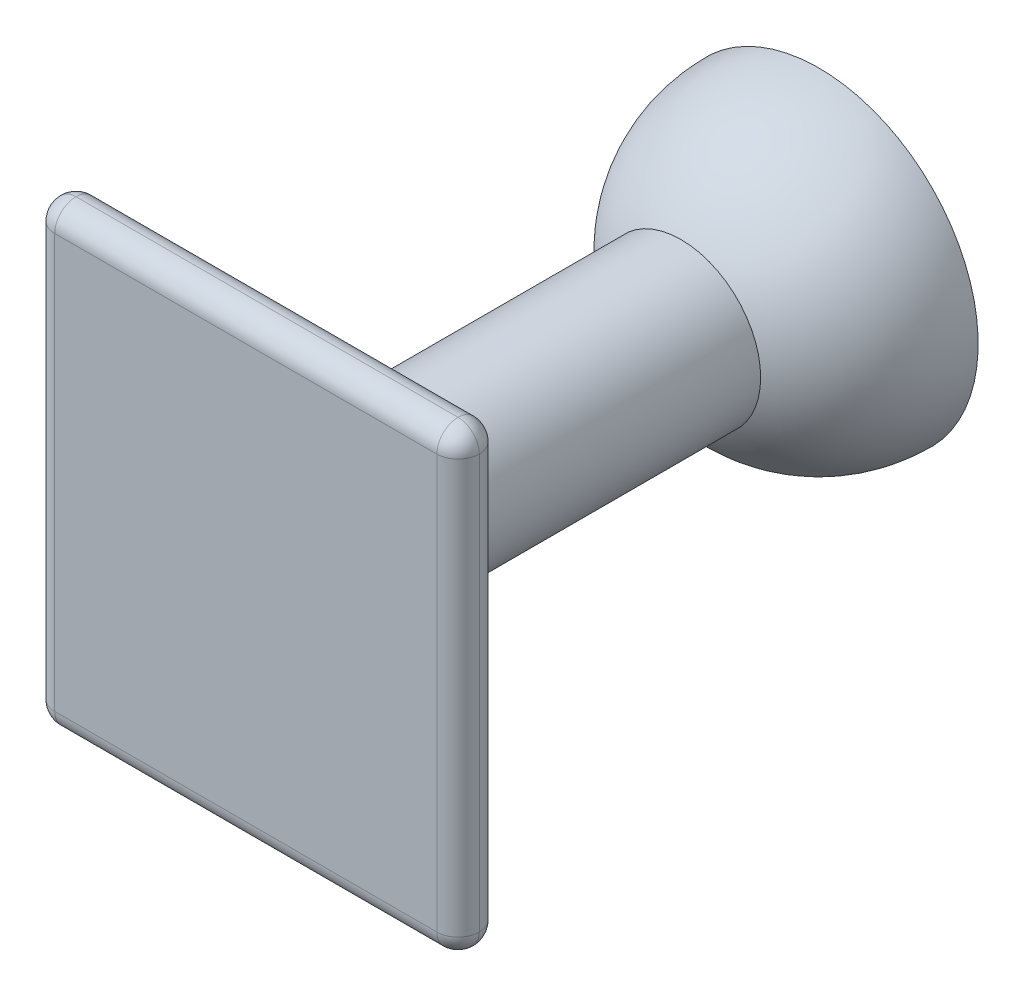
SolidWorks part; units mm, degrees
ref_plane "Front Plane" through (0, 0, 0) normal (0, 0, 1) x (1, 0, 0)
ref_plane "Top Plane" through (0, 0, 0) normal (0, 1, 0) x (1, 0, 0)
ref_plane "Right Plane" through (0, 0, 0) normal (1, 0, 0) x (0, 0, -1)
sketch "Sketch1" plane through (0, 0, 0) normal (1, 0, 0) x (0, 0, -1)
  line L0 (50, 15) -> (50, -15)
  line L1 (50, 0) -> (0, 0) construction
  arc A0 (50, -15) -> (50, 15) centre (50, 0) cw
  dimension "D1" = 30
  dimension "D2" = 50
revolve "Revolve1" add sketch "Sketch1" angle 180 about L0
sketch "Sketch3" plane through (0, 0, 0) normal (0, 1, 0) x (1, 0, 0)
  line L0 (-20, 0) -> (20, 0)
  dimension "D1" = 40
extrude "Extrude-Thin1" add sketch "Sketch3" along normal mid plane 43 thin
fillet "Fillet1" radius 2 8 edges at (20, 0, 4) (20, 0, 0) (-20, 0, 0) (-20, 0, 4) (0, 21.5, 0) (0, 21.5, 4) (0, -21.5, 0) (0, -21.5, 4)
sketch "Sketch4" plane through (0, 0, 0) normal (0, 0, 1) x (1, 0, 0)
  circle A0 centre (0, 0) radius 7.5
  dimension "D1" = 15
extrude "Extrude1" add sketch "Sketch4" against normal up to body separate body
